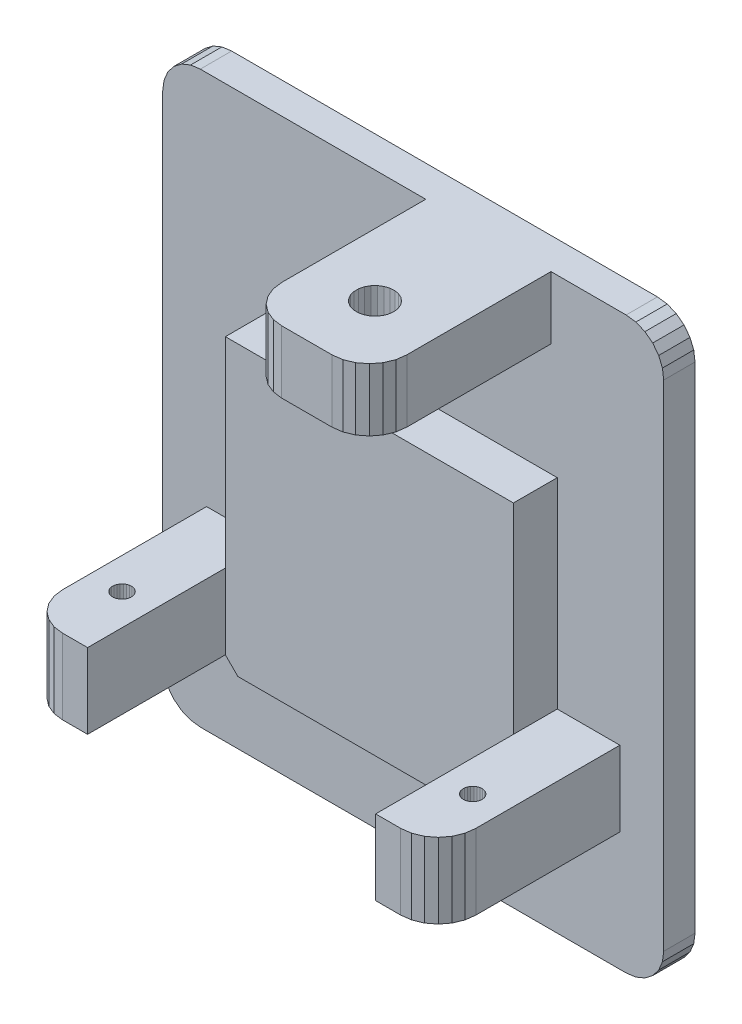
SolidWorks part; units mm, degrees
ref_plane "Front Plane" through (0, 0, 0) normal (0, 0, 1) x (1, 0, 0)
ref_plane "Top Plane" through (0, 0, 0) normal (0, 1, 0) x (1, 0, 0)
ref_plane "Right Plane" through (0, 0, 0) normal (1, 0, 0) x (0, 0, -1)
ref_plane "Plane1" through (0, 8.5, 0) normal (0, -1, 0) x (1, 0, 0)
sketch "Sketch1" plane through (0, 8.5, 0) normal (0, -1, 0) x (1, 0, 0)
  line L0 (3.5, 2.5) -> (36.5, 2.5)
  line L1 (36.5, 2.5) -> (36.5, 6)
  line L2 (36.5, 6) -> (3.5, 6)
  line L3 (3.5, 6) -> (3.5, 2.5)
  dimension "D1" = 33
  dimension "D2" = 3.5
extrude "Boss-Extrude1" add sketch "Sketch1" against normal blind 1
sketch "Sketch2" plane through (0, 9.5, 0) normal (0, 1, 0) x (-1, 0, 0)
  line L0 (-6.5, 17) -> (-5.7235, 16.8978)
  line L1 (-5.7235, 16.8978) -> (-5, 16.5981)
  line L2 (-5, 16.5981) -> (-4.3787, 16.1213)
  line L3 (-4.3787, 16.1213) -> (-3.9019, 15.5)
  line L4 (-3.9019, 15.5) -> (-3.6022, 14.7765)
  line L5 (-3.6022, 14.7765) -> (-3.5, 14)
  line L6 (-3.5, 14) -> (-3.5, 2.5)
  line L7 (-3.5, 2.5) -> (-36.5, 2.5)
  line L8 (-36.5, 2.5) -> (-36.5, 14)
  line L9 (-36.5, 14) -> (-36.3978, 14.7765)
  line L10 (-36.3978, 14.7765) -> (-36.0981, 15.5)
  line L11 (-36.0981, 15.5) -> (-35.6213, 16.1213)
  line L12 (-35.6213, 16.1213) -> (-35, 16.5981)
  line L13 (-35, 16.5981) -> (-34.2765, 16.8978)
  line L14 (-34.2765, 16.8978) -> (-33.5, 17)
  line L15 (-33.5, 17) -> (-6.5, 17)
  line L16 (-3.5, 6) -> (-3.5, 2.5) construction
  line L17 (-36.5, 6) -> (-3.5, 6) construction
  dimension "D1" = 0.1022
  dimension "D2" = 0.4019
  dimension "D3" = 0.8787
  dimension "D4" = 1.5
  dimension "D5" = 2.2235
  dimension "D6" = 3
  dimension "D7" = 30
  dimension "D8" = 30.7765
  dimension "D9" = 31.5
  dimension "D10" = 32.1213
  dimension "D11" = 32.5981
  dimension "D12" = 32.8978
  dimension "D13" = 33
  dimension "D14" = 8
  dimension "D15" = 8.7765
  dimension "D16" = 9.5
  dimension "D17" = 10.1213
  dimension "D18" = 10.5981
  dimension "D19" = 10.8978
  dimension "D20" = 11
  dimension "D21" = 3.5
extrude "Boss-Extrude2" add sketch "Sketch2" along normal blind 6
sketch "Sketch3" plane through (36.5, 0, 0) normal (1, 0, 0) x (0, 0, -1)
  line L0 (-2.5, 8.5) -> (-2.5, 9.5)
  line L1 (-2.5, 9.5) -> (-6, 9.5)
  line L2 (-6, 9.5) -> (-6, 8.5)
  line L3 (-6, 8.5) -> (-2.5, 8.5)
  line L4 (-2.5, 8.5) -> (-6, 8.5) construction
  dimension "D1" = 3.5
  dimension "D2" = 1
extrude "Cut-Extrude1" cut sketch "Sketch3" against normal blind 5
sketch "Sketch4" plane through (3.5, 0, 0) normal (-1, 0, 0) x (0, 0, 1)
  line L0 (2.5, 8.5) -> (6, 8.5)
  line L1 (6, 8.5) -> (6, 9.5)
  line L2 (6, 9.5) -> (2.5, 9.5)
  line L3 (2.5, 9.5) -> (2.5, 8.5)
  line L4 (6, 8.5) -> (2.5, 8.5) construction
  dimension "D1" = 3.5
  dimension "D2" = 1
extrude "Cut-Extrude2" cut sketch "Sketch4" against normal blind 6
ref_plane "Plane2" through (9.5, 0, 0) normal (-1, 0, 0) x (0, -1, 0)
sketch "Sketch5" plane through (9.5, 0, 0) normal (-1, 0, 0) x (0, -1, 0)
  line L0 (-9.5, 6) -> (-9.5, 17)
  line L1 (-9.5, 17) -> (-15.5, 17)
  line L2 (-15.5, 17) -> (-15.5, 6)
  line L3 (-15.5, 6) -> (-9.5, 6)
  dimension "D1" = 6
  dimension "D2" = 11
extrude "Cut-Extrude3" cut sketch "Sketch5" against normal blind 22
sketch "Sketch6" plane through (9.5, 0, 0) normal (1, 0, 0) x (0, 0, -1)
  line L0 (-6, 9.5) -> (-6, 15.5)
  line L1 (-6, 15.5) -> (-17, 15.5)
  line L2 (-17, 15.5) -> (-17, 9.5)
  line L3 (-17, 9.5) -> (-6, 9.5)
  line L4 (-17, 15.5) -> (-6, 15.5) construction
  dimension "D1" = 11
  dimension "D2" = 6
extrude "Cut-Extrude4" cut sketch "Sketch6" against normal blind 1
sketch "Sketch7" plane through (31.5, 0, 0) normal (1, 0, 0) x (0, 0, -1)
  line L0 (-2.5, 8.5) -> (-2.5, 9.5)
  line L1 (-2.5, 9.5) -> (-6, 9.5)
  line L2 (-6, 9.5) -> (-6, 8.5)
  line L3 (-6, 8.5) -> (-2.5, 8.5)
  line L4 (-6, 8.5) -> (-2.5, 8.5) construction
  dimension "D1" = 3.5
  dimension "D2" = 1
extrude "Cut-Extrude5" cut sketch "Sketch7" against normal blind 1
ref_plane "Plane3" through (0, 0, 2.5) normal (0, 0, 1) x (1, 0, 0)
sketch "Sketch8" plane through (0, 0, 2.5) normal (0, 0, 1) x (1, 0, 0)
  line L0 (40, 42.5) -> (39.8978, 43.2765)
  line L1 (39.8978, 43.2765) -> (39.5981, 44)
  line L2 (39.5981, 44) -> (39.1213, 44.6213)
  line L3 (39.1213, 44.6213) -> (38.5, 45.0981)
  line L4 (38.5, 45.0981) -> (37.7765, 45.3978)
  line L5 (37.7765, 45.3978) -> (37, 45.5)
  line L6 (37, 45.5) -> (3, 45.5)
  line L7 (3, 45.5) -> (2.2235, 45.3978)
  line L8 (2.2235, 45.3978) -> (1.5, 45.0981)
  line L9 (1.5, 45.0981) -> (0.8787, 44.6213)
  line L10 (0.8787, 44.6213) -> (0.4019, 44)
  line L11 (0.4019, 44) -> (0.1022, 43.2765)
  line L12 (0.1022, 43.2765) -> (0, 42.5)
  line L13 (0, 42.5) -> (0, 3)
  line L14 (0, 3) -> (0.1022, 2.2235)
  line L15 (0.1022, 2.2235) -> (0.4019, 1.5)
  line L16 (0.4019, 1.5) -> (0.8787, 0.8787)
  line L17 (0.8787, 0.8787) -> (1.5, 0.4019)
  line L18 (1.5, 0.4019) -> (2.2235, 0.1022)
  line L19 (2.2235, 0.1022) -> (3, 0)
  line L20 (3, 0) -> (37, 0)
  line L21 (37, 0) -> (37.7765, 0.1022)
  line L22 (37.7765, 0.1022) -> (38.5, 0.4019)
  line L23 (38.5, 0.4019) -> (39.1213, 0.8787)
  line L24 (39.1213, 0.8787) -> (39.5981, 1.5)
  line L25 (39.5981, 1.5) -> (39.8978, 2.2235)
  line L26 (39.8978, 2.2235) -> (40, 3)
  line L27 (40, 3) -> (40, 42.5)
  dimension "D1" = 0.1022
  dimension "D2" = 0.4019
  dimension "D3" = 0.8787
  dimension "D4" = 1.5
  dimension "D5" = 2.2235
  dimension "D6" = 3
  dimension "D7" = 37
  dimension "D8" = 37.7765
  dimension "D9" = 38.5
  dimension "D10" = 39.1213
  dimension "D11" = 39.5981
  dimension "D12" = 39.8978
  dimension "D13" = 40
  dimension "D14" = 0.1022
  dimension "D15" = 0.4019
  dimension "D16" = 0.8787
  dimension "D17" = 1.5
  dimension "D18" = 2.2235
  dimension "D19" = 3
  dimension "D20" = 42.5
  dimension "D21" = 43.2765
  dimension "D22" = 44
  dimension "D23" = 44.6213
  dimension "D24" = 45.0981
  dimension "D25" = 45.3978
  dimension "D26" = 45.5
extrude "Boss-Extrude3" add sketch "Sketch8" against normal blind 2.5
ref_plane "Plane4" through (0, 45.5, 0) normal (0, 1, 0) x (1, 0, 0)
sketch "Sketch9" plane through (0, 45.5, 0) normal (0, 1, 0) x (1, 0, 0)
  line L0 (31, -2.5) -> (21, -2.5)
  line L1 (21, -2.5) -> (21, -14)
  line L2 (21, -14) -> (21.1022, -14.7765)
  line L3 (21.1022, -14.7765) -> (21.4019, -15.5)
  line L4 (21.4019, -15.5) -> (21.8787, -16.1213)
  line L5 (21.8787, -16.1213) -> (22.5, -16.5981)
  line L6 (22.5, -16.5981) -> (23.2235, -16.8978)
  line L7 (23.2235, -16.8978) -> (24, -17)
  line L8 (24, -17) -> (28, -17)
  line L9 (28, -17) -> (28.7765, -16.8978)
  line L10 (28.7765, -16.8978) -> (29.5, -16.5981)
  line L11 (29.5, -16.5981) -> (30.1213, -16.1213)
  line L12 (30.1213, -16.1213) -> (30.5981, -15.5)
  line L13 (30.5981, -15.5) -> (30.8978, -14.7765)
  line L14 (30.8978, -14.7765) -> (31, -14)
  line L15 (31, -14) -> (31, -2.5)
  dimension "D1" = 0.1022
  dimension "D2" = 0.4019
  dimension "D3" = 0.8787
  dimension "D4" = 1.5
  dimension "D5" = 2.2235
  dimension "D6" = 3
  dimension "D7" = 7
  dimension "D8" = 7.7765
  dimension "D9" = 8.5
  dimension "D10" = 9.1213
  dimension "D11" = 9.5981
  dimension "D12" = 9.8978
  dimension "D13" = 10
  dimension "D14" = 0.1022
  dimension "D15" = 0.4019
  dimension "D16" = 0.8787
  dimension "D17" = 1.5
  dimension "D18" = 2.2235
  dimension "D19" = 3
  dimension "D20" = 14.5
extrude "Boss-Extrude4" add sketch "Sketch9" against normal blind 5
sketch "Sketch10" plane through (0, 40.5, 0) normal (0, -1, 0) x (1, 0, 0)
  line L0 (25.3613, 12.9072) -> (25.0439, 12.7058)
  line L1 (25.0439, 12.7058) -> (24.7865, 12.4317)
  line L2 (24.7865, 12.4317) -> (24.6053, 12.1022)
  line L3 (24.6053, 12.1022) -> (24.5118, 11.738)
  line L4 (24.5118, 11.738) -> (24.5118, 11.362)
  line L5 (24.5118, 11.362) -> (24.6053, 10.9978)
  line L6 (24.6053, 10.9978) -> (24.7865, 10.6683)
  line L7 (24.7865, 10.6683) -> (25.0439, 10.3942)
  line L8 (25.0439, 10.3942) -> (25.3613, 10.1928)
  line L9 (25.3613, 10.1928) -> (25.7189, 10.0766)
  line L10 (25.7189, 10.0766) -> (26.0942, 10.053)
  line L11 (26.0942, 10.053) -> (26.4635, 10.1234)
  line L12 (26.4635, 10.1234) -> (26.8037, 10.2835)
  line L13 (26.8037, 10.2835) -> (27.0935, 10.5232)
  line L14 (27.0935, 10.5232) -> (27.3145, 10.8274)
  line L15 (27.3145, 10.8274) -> (27.4529, 11.177)
  line L16 (27.4529, 11.177) -> (27.5, 11.55)
  line L17 (27.5, 11.55) -> (27.4529, 11.923)
  line L18 (27.4529, 11.923) -> (27.3145, 12.2726)
  line L19 (27.3145, 12.2726) -> (27.0935, 12.5768)
  line L20 (27.0935, 12.5768) -> (26.8037, 12.8165)
  line L21 (26.8037, 12.8165) -> (26.4635, 12.9766)
  line L22 (26.4635, 12.9766) -> (26.0942, 13.047)
  line L23 (26.0942, 13.047) -> (25.7189, 13.0234)
  line L24 (25.7189, 13.0234) -> (25.3613, 12.9072)
  line L25 (31, 14) -> (31, 2.5) construction
  dimension "D1" = 3.5
  dimension "D2" = 3.5471
  dimension "D3" = 3.6855
  dimension "D4" = 3.9065
  dimension "D5" = 4.1963
  dimension "D6" = 4.5365
  dimension "D7" = 4.9058
  dimension "D8" = 5.2811
  dimension "D9" = 5.6387
  dimension "D10" = 5.9561
  dimension "D11" = 6.2135
  dimension "D12" = 6.3947
  dimension "D13" = 6.4882
  dimension "D14" = 3.953
  dimension "D15" = 3.9766
  dimension "D16" = 4.0234
  dimension "D17" = 4.0928
  dimension "D18" = 4.1835
  dimension "D19" = 4.2942
  dimension "D20" = 4.4232
  dimension "D21" = 4.5683
  dimension "D22" = 4.7274
  dimension "D23" = 4.8978
  dimension "D24" = 5.077
  dimension "D25" = 5.262
  dimension "D26" = 5.45
  dimension "D27" = 5.638
  dimension "D28" = 5.823
  dimension "D29" = 6.0022
  dimension "D30" = 6.1726
  dimension "D31" = 6.3317
  dimension "D32" = 6.4768
  dimension "D33" = 6.6058
  dimension "D34" = 6.7165
  dimension "D35" = 6.8072
  dimension "D36" = 6.8766
  dimension "D37" = 6.9234
  dimension "D38" = 6.947
extrude "Cut-Extrude6" cut sketch "Sketch10" against normal through all
sketch "Sketch11" plane through (0, 15.5, 0) normal (0, 1, 0) x (-1, 0, 0)
  line L0 (-6.2318, 12.4633) -> (-6.4019, 12.3832)
  line L1 (-6.4019, 12.3832) -> (-6.5467, 12.2634)
  line L2 (-6.5467, 12.2634) -> (-6.6572, 12.1113)
  line L3 (-6.6572, 12.1113) -> (-6.7264, 11.9365)
  line L4 (-6.7264, 11.9365) -> (-6.75, 11.75)
  line L5 (-6.75, 11.75) -> (-6.7264, 11.5635)
  line L6 (-6.7264, 11.5635) -> (-6.6572, 11.3887)
  line L7 (-6.6572, 11.3887) -> (-6.5467, 11.2366)
  line L8 (-6.5467, 11.2366) -> (-6.4019, 11.1168)
  line L9 (-6.4019, 11.1168) -> (-6.2318, 11.0367)
  line L10 (-6.2318, 11.0367) -> (-6.0471, 11.0015)
  line L11 (-6.0471, 11.0015) -> (-5.8595, 11.0133)
  line L12 (-5.8595, 11.0133) -> (-5.6807, 11.0714)
  line L13 (-5.6807, 11.0714) -> (-5.5219, 11.1721)
  line L14 (-5.5219, 11.1721) -> (-5.3932, 11.3092)
  line L15 (-5.3932, 11.3092) -> (-5.3027, 11.4739)
  line L16 (-5.3027, 11.4739) -> (-5.2559, 11.656)
  line L17 (-5.2559, 11.656) -> (-5.2559, 11.844)
  line L18 (-5.2559, 11.844) -> (-5.3027, 12.0261)
  line L19 (-5.3027, 12.0261) -> (-5.3932, 12.1908)
  line L20 (-5.3932, 12.1908) -> (-5.5219, 12.3279)
  line L21 (-5.5219, 12.3279) -> (-5.6807, 12.4286)
  line L22 (-5.6807, 12.4286) -> (-5.8595, 12.4867)
  line L23 (-5.8595, 12.4867) -> (-6.0471, 12.4985)
  line L24 (-6.0471, 12.4985) -> (-6.2318, 12.4633)
  line L25 (-8.5, 6) -> (-8.5, 17) construction
  line L26 (-31.5, 6) -> (-8.5, 6) construction
  dimension "D1" = 1.75
  dimension "D2" = 1.7736
  dimension "D3" = 1.8428
  dimension "D4" = 1.9533
  dimension "D5" = 2.0981
  dimension "D6" = 2.2682
  dimension "D7" = 2.4529
  dimension "D8" = 2.6405
  dimension "D9" = 2.8193
  dimension "D10" = 2.9781
  dimension "D11" = 3.1068
  dimension "D12" = 3.1973
  dimension "D13" = 3.2441
  dimension "D14" = 5.0015
  dimension "D15" = 5.0133
  dimension "D16" = 5.0367
  dimension "D17" = 5.0714
  dimension "D18" = 5.1168
  dimension "D19" = 5.1721
  dimension "D20" = 5.2366
  dimension "D21" = 5.3092
  dimension "D22" = 5.3887
  dimension "D23" = 5.4739
  dimension "D24" = 5.5635
  dimension "D25" = 5.656
  dimension "D26" = 5.75
  dimension "D27" = 5.844
  dimension "D28" = 5.9365
  dimension "D29" = 6.0261
  dimension "D30" = 6.1113
  dimension "D31" = 6.1908
  dimension "D32" = 6.2634
  dimension "D33" = 6.3279
  dimension "D34" = 6.3832
  dimension "D35" = 6.4286
  dimension "D36" = 6.4633
  dimension "D37" = 6.4867
  dimension "D38" = 6.4985
extrude "Cut-Extrude7" cut sketch "Sketch11" against normal through all
sketch "Sketch12" plane through (0, 9.5, 0) normal (0, -1, 0) x (1, 0, 0)
  line L0 (33.8595, 12.4867) -> (33.6807, 12.4286)
  line L1 (33.6807, 12.4286) -> (33.5219, 12.3279)
  line L2 (33.5219, 12.3279) -> (33.3932, 12.1908)
  line L3 (33.3932, 12.1908) -> (33.3027, 12.0261)
  line L4 (33.3027, 12.0261) -> (33.2559, 11.844)
  line L5 (33.2559, 11.844) -> (33.2559, 11.656)
  line L6 (33.2559, 11.656) -> (33.3027, 11.4739)
  line L7 (33.3027, 11.4739) -> (33.3932, 11.3092)
  line L8 (33.3932, 11.3092) -> (33.5219, 11.1721)
  line L9 (33.5219, 11.1721) -> (33.6807, 11.0714)
  line L10 (33.6807, 11.0714) -> (33.8595, 11.0133)
  line L11 (33.8595, 11.0133) -> (34.0471, 11.0015)
  line L12 (34.0471, 11.0015) -> (34.2318, 11.0367)
  line L13 (34.2318, 11.0367) -> (34.4019, 11.1168)
  line L14 (34.4019, 11.1168) -> (34.5467, 11.2366)
  line L15 (34.5467, 11.2366) -> (34.6572, 11.3887)
  line L16 (34.6572, 11.3887) -> (34.7264, 11.5635)
  line L17 (34.7264, 11.5635) -> (34.75, 11.75)
  line L18 (34.75, 11.75) -> (34.7264, 11.9365)
  line L19 (34.7264, 11.9365) -> (34.6572, 12.1113)
  line L20 (34.6572, 12.1113) -> (34.5467, 12.2634)
  line L21 (34.5467, 12.2634) -> (34.4019, 12.3832)
  line L22 (34.4019, 12.3832) -> (34.2318, 12.4633)
  line L23 (34.2318, 12.4633) -> (34.0471, 12.4985)
  line L24 (34.0471, 12.4985) -> (33.8595, 12.4867)
  line L25 (30.5, 2.5) -> (30.5, 6) construction
  line L26 (30.5, 2.5) -> (36.5, 2.5) construction
  dimension "D1" = 2.7559
  dimension "D2" = 2.8027
  dimension "D3" = 2.8932
  dimension "D4" = 3.0219
  dimension "D5" = 3.1807
  dimension "D6" = 3.3595
  dimension "D7" = 3.5471
  dimension "D8" = 3.7318
  dimension "D9" = 3.9019
  dimension "D10" = 4.0467
  dimension "D11" = 4.1572
  dimension "D12" = 4.2264
  dimension "D13" = 4.25
  dimension "D14" = 8.5015
  dimension "D15" = 8.5133
  dimension "D16" = 8.5367
  dimension "D17" = 8.5714
  dimension "D18" = 8.6168
  dimension "D19" = 8.6721
  dimension "D20" = 8.7366
  dimension "D21" = 8.8092
  dimension "D22" = 8.8887
  dimension "D23" = 8.9739
  dimension "D24" = 9.0635
  dimension "D25" = 9.156
  dimension "D26" = 9.25
  dimension "D27" = 9.344
  dimension "D28" = 9.4365
  dimension "D29" = 9.5261
  dimension "D30" = 9.6113
  dimension "D31" = 9.6908
  dimension "D32" = 9.7634
  dimension "D33" = 9.8279
  dimension "D34" = 9.8832
  dimension "D35" = 9.9286
  dimension "D36" = 9.9633
  dimension "D37" = 9.9867
  dimension "D38" = 9.9985
extrude "Cut-Extrude8" cut sketch "Sketch12" against normal through all
draft "Draft1" type of draft neutral plane draft angle 45 faces to draft 2 parameters "D1"=45
ref_plane "Plane5" through (20, 0, 0) normal (1, 0, 0) x (0, 0, -1)
sketch "Sketch13" plane through (20, 0, 0) normal (1, 0, 0) x (0, 0, -1)
  line L0 (-2.5, 31.5) -> (-6, 31.5)
  line L1 (-6, 31.5) -> (-6, 15.5)
  dimension "D1" = 3.5
  dimension "D2" = 16
rib "Rib1" sketch "Sketch13" sketch "Sketch13" thickness 23 extrusion direction parallel to sketch draft on no parameters "D1"=23
sketch "Sketch14" plane through (0, 15.5, 0) normal (0, 1, 0) x (1, 0, 0)
  circle A0 centre (34, -11.75) radius 0.75
  circle A2 centre (6, -11.75) radius 0.75
